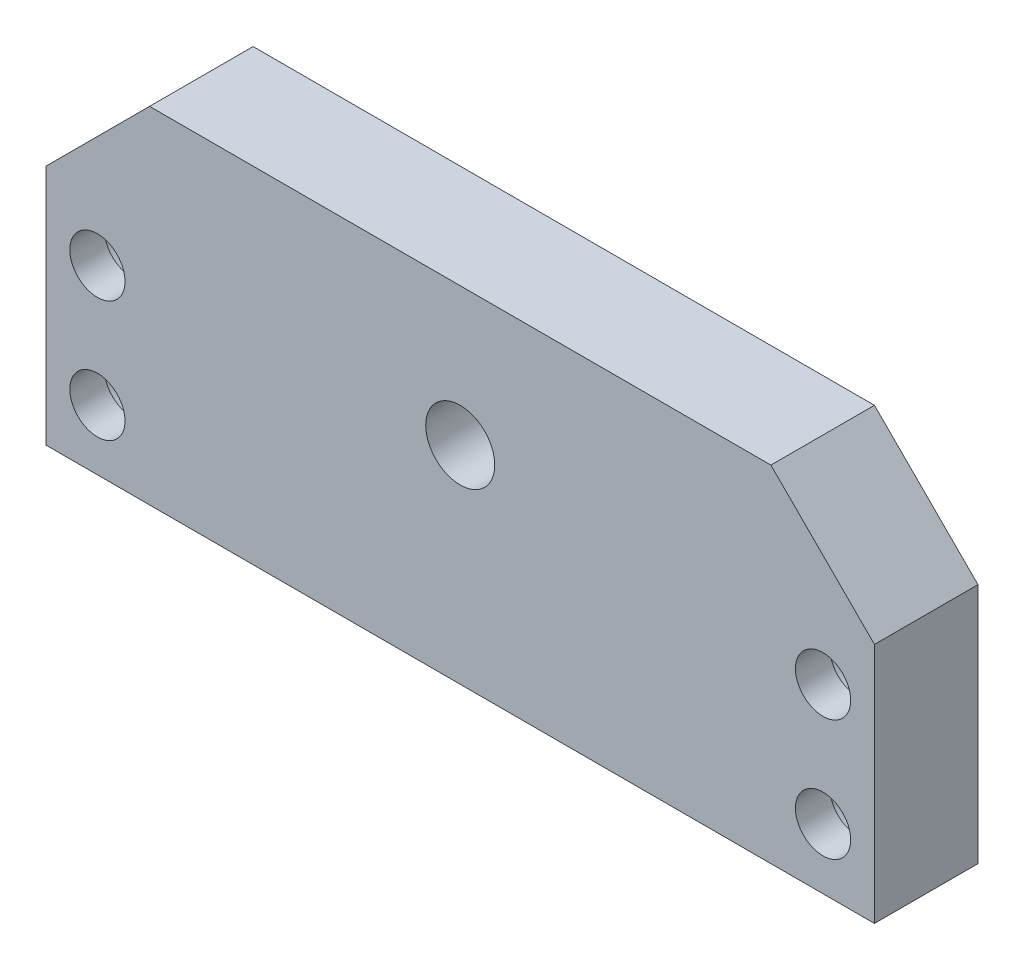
SolidWorks part; units mm, degrees
ref_plane "Front Plane" through (0, 0, 0) normal (0, 0, 1) x (1, 0, 0)
ref_plane "Top Plane" through (0, 0, 0) normal (0, 1, 0) x (1, 0, 0)
ref_plane "Right Plane" through (0, 0, 0) normal (1, 0, 0) x (0, 0, -1)
sketch "Sketch1" plane through (0, 0, 0) normal (0, 0, 1) x (1, 0, 0)
  line L1 (-60, -25) -> (60, -25)
  line L2 (-60, -25) -> (-60, 25)
  line L3 (-60, 25) -> (60, 25)
  line L4 (60, -25) -> (60, 25)
  line L5 (-60, -25) -> (60, 25) construction
  line L6 (-60, 25) -> (60, -25) construction
  point P0 (0, 0)
  dimension "D1" = 50
  dimension "D2" = 120
extrude "Boss-Extrude1" add sketch "Sketch1" along normal blind 15
chamfer "Chamfer1" distance 15 angle 45 2 edges at (-60, 25, 7.5) (60, 25, 7.5)
sketch "Sketch2" plane through (0, 0, 0) normal (0, 0, -1) x (-1, 0, 0)
  line L2 (60, -25) -> (-60, -25) construction
  line L5 (-60.0071, 10) -> (-60, 10)
  line L6 (0, 0) -> (0, -10.9806)
  line L7 (-52.5535, -25) -> (-52.5535, -7.5) construction
  line L8 (-52.5535, -7.5) -> (-52.5535, 10) construction
  circle A0 centre (-52.5535, 1.25) radius 6.25
  circle A1 centre (-52.5535, -16.25) radius 6.25
  circle A2 centre (52.5535, -16.25) radius 6.25
  circle A3 centre (52.5535, 1.25) radius 6.25
  dimension "D4" = 12.5
extrude "Cut-Extrude1" cut sketch "Sketch2" against normal blind 10 contours A0 | A1 | A3 | A2
sketch "Sketch3" plane through (0, 0, 10) normal (0, 0, -1) x (-1, 0, 0)
  circle A0 centre (-52.5535, 1.25) radius 4
  circle A1 centre (-52.5535, -16.25) radius 4
  circle A2 centre (52.5535, -16.25) radius 4
  circle A3 centre (52.5535, 1.25) radius 4
  dimension "D1" = 8
extrude "Cut-Extrude2" cut sketch "Sketch3" against normal blind 10
sketch "Sketch4" plane through (0, 0, 0) normal (0, 0, -1) x (-1, 0, 0)
  line L0 (60, -25) -> (-60, -25) construction
  circle A0 centre (0, 5) radius 5
  dimension "D2" = 10
  dimension "D1" = 30
extrude "Cut-Extrude3" cut sketch "Sketch4" against normal blind 50
